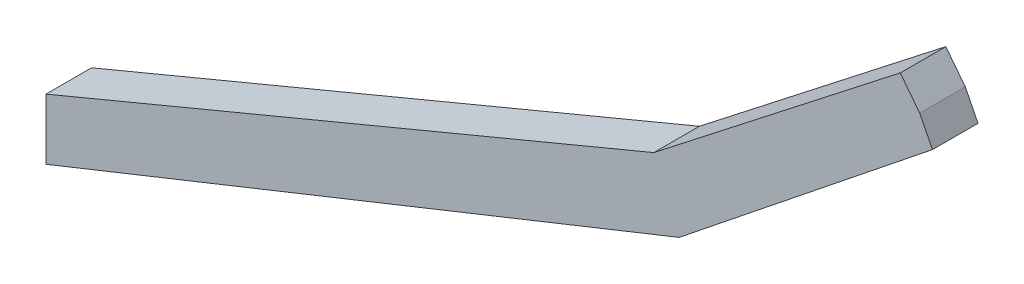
SolidWorks part; units mm, degrees
ref_plane "Front Plane" through (0, 0, 0) normal (0, 0, 1) x (1, 0, 0)
ref_plane "Top Plane" through (0, 0, 0) normal (0, 1, 0) x (1, 0, 0)
ref_plane "Right Plane" through (0, 0, 0) normal (1, 0, 0) x (0, 0, -1)
sketch "Sketch1" plane through (0, 0, 0) normal (0, 0, 1) x (1, 0, 0)
  line L0 (0, 0) -> (25000, 10000)
  line L1 (25000, 10000) -> (35000, 18000)
  line L2 (35000, 18000) -> (34500, 19000)
  line L3 (34500, 19000) -> (24500, 11200)
  line L4 (24500, 11200) -> (0, 1200)
  line L5 (0, 1200) -> (0, 0)
extrude "Boss-Extrude1" add sketch "Sketch1" along normal blind 1800
sketch "Sketch2" plane through (0, 0, 0) normal (0, 0, 1) x (1, 0, 0)
  line L0 (0, 1200) -> (24500, 11200)
  line L1 (24500, 11200) -> (34500, 19000)
  line L2 (34500, 19000) -> (33728.9232, 19988.5601)
  line L3 (33728.9232, 19988.5601) -> (24000, 12400)
  line L4 (24000, 12400) -> (0, 2400)
  line L5 (0, 2400) -> (0, 1200)
extrude "Boss-Extrude2" add sketch "Sketch2" along normal blind 1800
